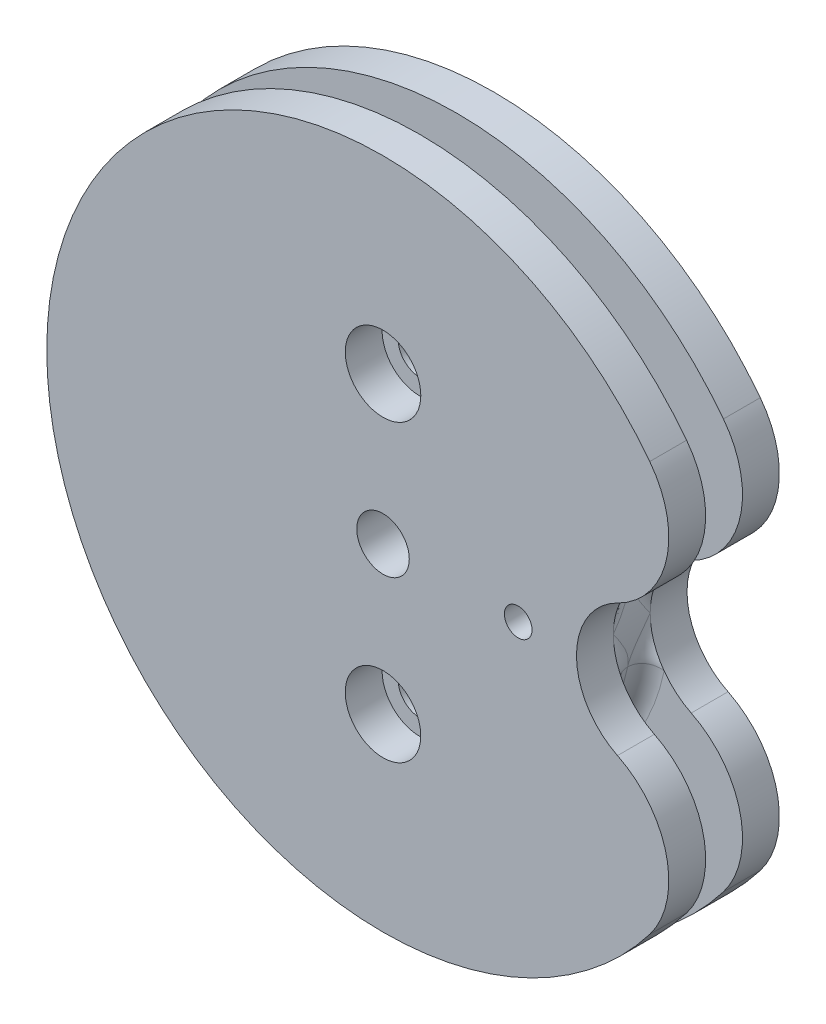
SolidWorks part; units mm, degrees
ref_plane "Front Plane" through (0, 0, 0) normal (0, 0, 1) x (1, 0, 0)
ref_plane "Top Plane" through (0, 0, 0) normal (0, 1, 0) x (1, 0, 0)
ref_plane "Right Plane" through (0, 0, 0) normal (1, 0, 0) x (0, 0, -1)
sketch "values-params_print" plane through (0, 0, 0) normal (0, 0, 1) x (1, 0, 0)
  line L0 (0, 0) -> (0.7, 0) construction
  line L1 (0, -5.2349) -> (3, -5.2349) construction
  line L2 (0, -10.104) -> (4, -10.104) construction
  line L3 (0, -15.1093) -> (105, -15.1093) construction
  line L4 (0, -19.837) -> (0.15, -19.837) construction
  line L5 (0, -24.2596) -> (0.4, -24.2596) construction
  line L6 (0, -28.606) -> (3.175, -28.606) construction
  line L7 (0, -33.0286) -> (9.5, -33.0286) construction
  line L8 (0, -37.6038) -> (2.4, -37.6038) construction
  line L9 (0, -43.1661) -> (6.35, -43.1661) construction
  dimension "width destroy" = 0.7
  dimension "width keep" = 3
  dimension "width tab" = 4
  dimension "base diameter" = 105
  dimension "print fit" = 0.15
  dimension "print free" = 0.4
  dimension "pin diameter" = 3.175
  dimension "pulley diameter" = 9.5
  dimension "pulley thickness" = 2.4
  dimension "base pin diameter" = 6.35
inserted part "params_print"
sketch "Sketch1" plane through (0, 0, 0) normal (0, 0, 1) x (1, 0, 0)
  line L0 (0, 18.25) -> (0, -18.25) construction
  line L1 (0, 0) -> (-18.25, 0) construction
  circle A0 centre (0, 0) radius 18.25
  circle A1 centre (0, 0) radius 4.175
  circle A2 centre (0, 8) radius 2.05
  circle A3 centre (0, -8) radius 2.05
  point P24 (0, 0)
  dimension "D1" = 36.5
  dimension "D2" = 8.35
  dimension "D3" = 4.1
  dimension "D4" = 8
extrude "Main Body" add sketch "Sketch1" along normal mid plane 6
sketch "Sketch2" plane through (0, 0, 3) normal (0, 0, 1) x (1, 0, 0)
  circle A0 centre (0, 0) radius 4.175 construction
  circle A1 centre (0, 0) radius 4.175
  circle A2 centre (0, 0) radius 1.425
  dimension "D1" = 2.85
extrude "Main Bolt Surface" add sketch "Sketch2" against normal offset from surface (3.15 mm away) 2.85
sketch "Sketch4" plane through (0, 0, 0) normal (0, 0, 1) x (1, 0, 0)
  circle A0 centre (0, 0) radius 18.25 construction
  circle A1 centre (0, 0) radius 18.25
  circle A2 centre (0, 0) radius 10.5
  circle A3 centre (0, 8) radius 2.05 construction
  circle A4 centre (0, 8) radius 2.05 construction
  dimension "D1" = 21
extrude "Pulley Slot" cut sketch "Sketch4" against normal mid plane 2
sketch "Sketch5" plane through (0, 0, -3) normal (0, 0, -1) x (-1, 0, 0)
  line L0 (0, 0) -> (18.25, 0) construction
  circle A1 centre (0, 8) radius 2.05 construction
  circle A8 centre (0, 0) radius 18.25 construction
  circle A9 centre (0, 8) radius 2.05
  circle A10 centre (0, -8) radius 1.175
  circle A11 centre (0, -8) radius 2.05
  circle A16 centre (0, 8) radius 1.175
  dimension "D1" = 2.35
extrude "Support Bolt Surface" add sketch "Sketch5" against normal offset from surface (4 mm away) 2
sketch "Sketch6" plane through (0, 0, 3) normal (0, 0, 1) x (1, 0, 0)
  line L0 (0, 18.25) -> (0, -18.25) construction
  line L1 (0, 0) -> (14.5, 0) construction
  circle A0 centre (0, 0) radius 18.25 construction
  circle A1 centre (14.5, 0) radius 4
  circle A3 centre (0, 0) radius 10.5 construction
  dimension "D1" = 8
extrude "Tendon Anchor Clearance" cut sketch "Sketch6" against normal through all
fillet "Inner Contouring" radius 1 2 edges at (10.5, 0, -1) (10.5, 0, 1)
sketch "Sketch8" plane through (0, 0, -3) normal (0, 0, -1) x (-1, 0, 0)
  line L0 (-4.175, 0) -> (-10.5, 0) construction
  line L1 (0, 0) -> (0, 15) construction
  circle A2 centre (0, 0) radius 4.175 construction
  arc A3 (-18.1832, -1.5602) -> (-18.1832, 1.5602) centre (-14.5, 0) ccw construction
  circle A4 centre (-7.3375, 0) radius 0.75
  dimension "D1" = 1.5
extrude "Tendon Anchor" cut sketch "Sketch8" against normal through all
fillet "Contouring" radius 5 4 edges at (18.1832, -1.5602, 2) (18.1832, 1.5602, 2) (18.1832, -1.5602, -2) (18.1832, 1.5602, -2)
ref_point "Ref Center"
equation "\"D2@Sketch1\" = 8 + \"print free@values@params_print.SLDPRT\""
equation "\"D3@Sketch1\" = 3.75 + \"print free@values@params_print.SLDPRT\""
equation "\"D1@Sketch5\" = 2 + \"print free@values@params_print.SLDPRT\""
equation "\"D1@Sketch2\" = 2.5 + \"print free@values@params_print.SLDPRT\""
equation "\"D1@Sketch8\" = \"width keep@values@params_print.SLDPRT\" / 2"
